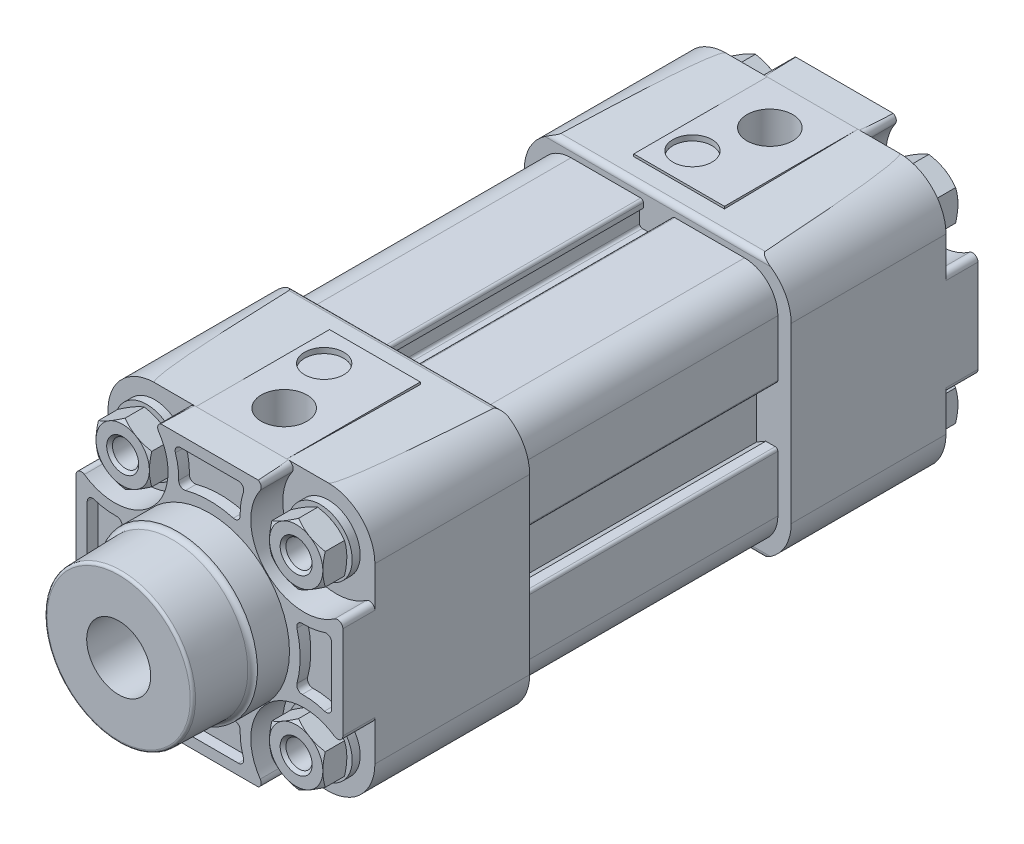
SolidWorks part; units mm, degrees
ref_plane "Face" through (0, 0, 0) normal (0, 0, 1) x (1, 0, 0)
ref_plane "Dessus" through (0, 0, 0) normal (0, 1, 0) x (1, 0, 0)
ref_plane "Profil" through (0, 0, 0) normal (1, 0, 0) x (0, 0, -1)
imported_body "Importée1"
sketch "Esquisse1" plane through (0, 0, -25) normal (0, 0, 1) x (1, 0, 0)
  circle A0 centre (0, 0) radius 16
  dimension "D1" = 32
extrude "Alésage Ø32" cut sketch "Esquisse1" against normal blind 60
sketch "Esquisse3" plane through (0, 0, -25) normal (0, 0, -1) x (-1, 0, 0)
  circle A0 centre (0, 0) radius 11
  dimension "D1" = 22
extrude "Enlèv. mat.-Extru.3" cut sketch "Esquisse3" against normal blind 16
sketch "Esquisse4" plane through (0, 0, -85) normal (0, 0, 1) x (1, 0, 0)
  circle A0 centre (0, 0) radius 11
  circle A1 centre (0, 0) radius 11 construction
extrude "Enlèv. mat.-Extru.4" cut sketch "Esquisse4" against normal blind 25
sketch "Esquisse5" plane through (0, 18.5, 0) normal (0, 1, 0) x (-1, 0, 0)
  circle A1 centre (0, -14) radius 4.283
  circle A2 centre (0, -14) radius 4.283
  dimension "D1" = 0
extrude "Enlèv. mat.-Extru.5" cut sketch "Esquisse5" against normal up to next
sketch "Esquisse6" plane through (0, 18.5, 0) normal (0, 1, 0) x (-1, 0, 0)
  circle A1 centre (0, -105) radius 4.283
  circle A2 centre (0, -105) radius 4.283
  dimension "D1" = 0
extrude "Enlèv. mat.-Extru.6" cut sketch "Esquisse6" against normal up to next
sketch "Esquisse7" plane through (0, 0, -123) normal (0, 0, -1) x (-1, 0, 0)
  line L0 (0, 0) -> (0, 25)
  line L2 (0, 0) -> (-25, 0)
  line L4 (-25, -8.6981) -> (-25, 8.6981) construction
  line L7 (8.5, 25) -> (-8.5, 25) construction
extrude "Coupe au quart" cut sketch "Esquisse7" against normal through all and the other way through all flip side to cut
